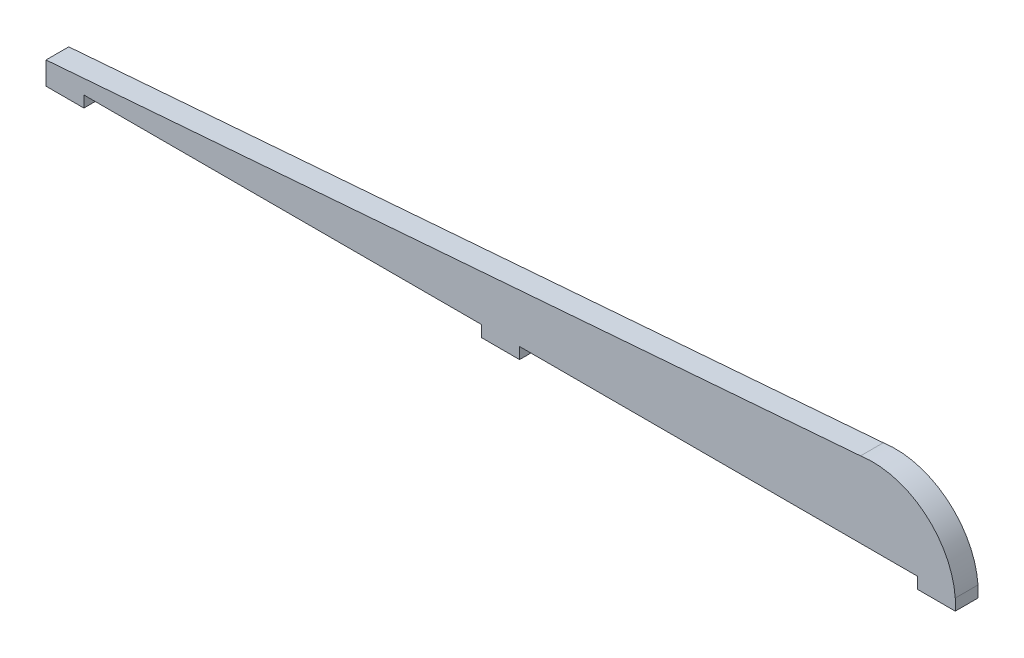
SolidWorks part; units mm, degrees
ref_plane "Front Plane" through (0, 0, 0) normal (0, 0, 1) x (1, 0, 0)
ref_plane "Top Plane" through (0, 0, 0) normal (0, 1, 0) x (1, 0, 0)
ref_plane "Right Plane" through (0, 0, 0) normal (1, 0, 0) x (0, 0, -1)
sketch "Sketch1" plane through (0, 0, 0) normal (0, 0, 1) x (1, 0, 0)
  line L0 (0, -1868.7679) -> (0, 91569.629) construction
  line L1 (-1868.7679, 0) -> (-120, 0) construction
  line L2 (120, 0) -> (120, -3)
  line L3 (-110, 0) -> (-5, 0)
  line L4 (-120, 0) -> (-120, 3)
  line L5 (-120, 3) -> (95, 20)
  line L7 (-110, 0) -> (-5, 0) construction
  line L8 (-120, 0) -> (-120, -3)
  line L9 (-120, -3) -> (-110, -3)
  line L10 (-110, 0) -> (-110, -3)
  line L11 (5, 0) -> (91569.629, 0) construction
  line L12 (-5, 0) -> (-5, -3)
  line L13 (-5, -3) -> (5, -3)
  line L14 (5, 0) -> (5, -3)
  line L15 (120, -3) -> (110, -3)
  line L16 (110, 0) -> (110, -3)
  line L17 (5, 0) -> (110, 0)
  line L18 (95, 23.0743) -> (95, -23.0743) construction
  arc A0 (120, 0) -> (95, 20) centre (98.1838, -1.6452) ccw
  point P22 (95, 0)
  dimension "D7" = 21.8781
  dimension "D1" = 240
  dimension "D2" = 20
  dimension "D3" = 3
  dimension "D4" = 10
  dimension "D5" = 3
  dimension "D6" = 215
extrude "Boss-Extrude2" add sketch "Sketch1" along normal blind 6 contours L5 A0 L2 L15 L16 L17 L14 L13 L12 L3 L10 L9 L8 L4
